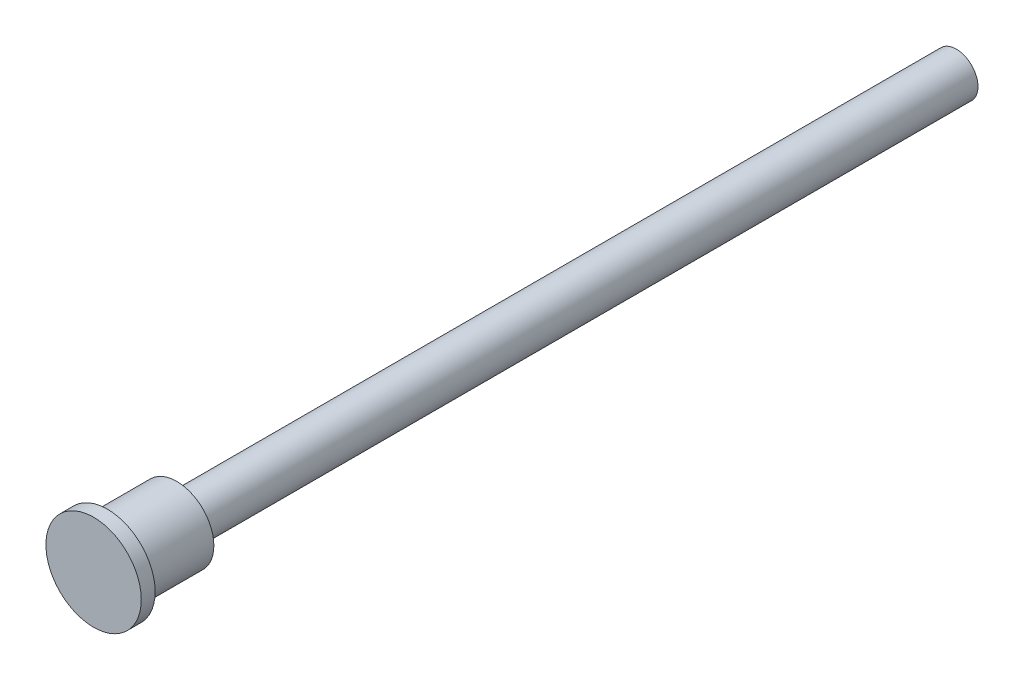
SolidWorks part; units mm, degrees
ref_plane "Front Plane" through (0, 0, 0) normal (0, 0, 1) x (1, 0, 0)
ref_plane "Top Plane" through (0, 0, 0) normal (0, 1, 0) x (1, 0, 0)
ref_plane "Right Plane" through (0, 0, 0) normal (1, 0, 0) x (0, 0, -1)
sketch "Sketch1" plane through (0, 0, 0) normal (0, 0, 1) x (1, 0, 0)
  circle A0 centre (0, 0) radius 1.25
extrude "Boss-Extrude1" add sketch "Sketch1" along normal blind 44.9999
sketch "Sketch2" plane through (0, 0, 44.9999) normal (0, 0, 1) x (1, 0, 0)
  circle A0 centre (0, 0) radius 2.1418
extrude "Boss-Extrude2" add sketch "Sketch2" along normal blind 4
sketch "Sketch3" plane through (0, 0, 48.9999) normal (0, 0, 1) x (1, 0, 0)
  circle A0 centre (0, 0) radius 2.7524
extrude "Boss-Extrude3" add sketch "Sketch3" along normal blind 0.8
